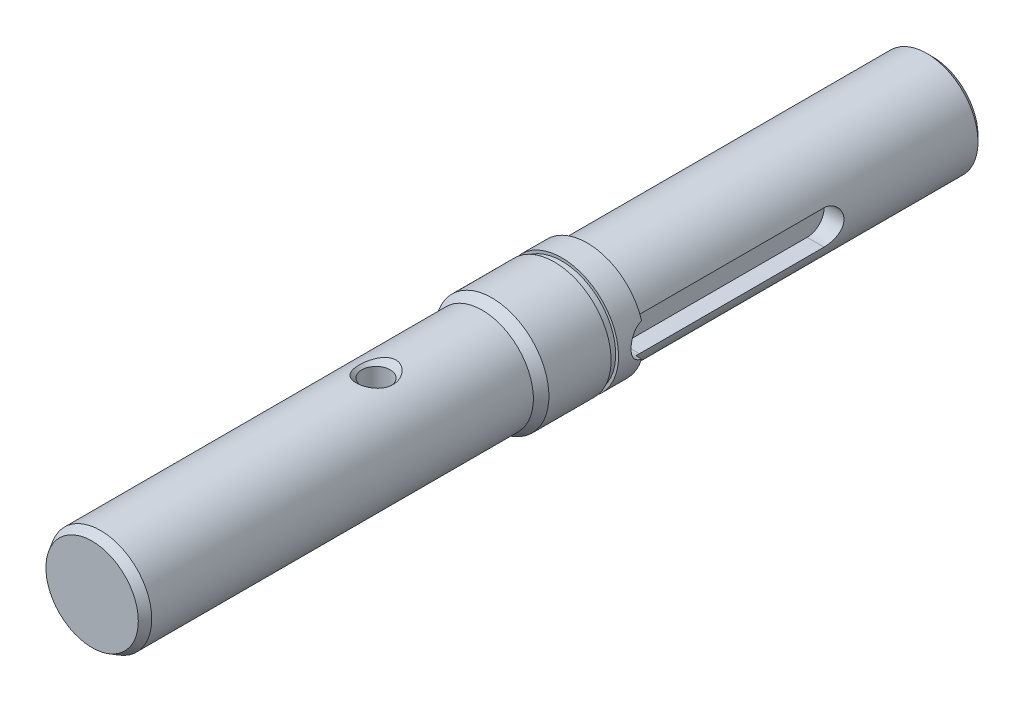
SolidWorks part; units mm, degrees
ref_plane "Face" through (0, 0, 0) normal (0, 0, 1) x (1, 0, 0)
ref_plane "Dessus" through (0, 0, 0) normal (0, 1, 0) x (1, 0, 0)
ref_plane "Droite" through (0, 0, 0) normal (1, 0, 0) x (0, 0, -1)
sketch "Esquisse1" plane through (0, 0, 0) normal (0, 0, 1) x (1, 0, 0)
  circle A0 centre (0, 0) radius 9
  dimension "D1" = 18
extrude "Base-Extrusion" add sketch "Esquisse1" along normal blind 148
chamfer "Chanfrein1" distance 1 angle 45 1 edges at (9, 0, 0)
hole_wizard "Trou taraudé M8x1.251" positions "Esquisse6" profile "Esquisse5" tap size "M8x1.25" standard "ISO"
sketch "Esquisse6" plane through (0, 0, 0) normal (0, 0, -1) x (-1, 0, 0)
  point P0 (0, 0)
sketch "Esquisse5" plane through (0, 0, 0) normal (1, 0, 0) x (0, 1, 0)
  line L0 (0, 0) -> (0, 32.5429)
  line L1 (0, 32.5429) -> (3.4, 30.5)
  line L2 (3.4, 30.5) -> (3.4, 0)
  line L5 (3.4, 0) -> (0, 0)
  line L10 (0, 32.5429) -> (-3.4, 30.5) construction
  line L11 (0, -6.35) -> (0, 107.95) construction
  dimension "Diamètre du perçage" = 6.8
  dimension "Profondeur du perçage" = 30.5
  dimension "Angle de pointe" = 118
ref_plane "Plan1" through (5.5, 0, 0) normal (1, 0, 0) x (0, 0, -1)
sketch "Esquisse11" plane through (0, 0, 0) normal (0, 1, 0) x (1, 0, 0)
  line L0 (0, 0) -> (0, -148.7529) construction
  line L1 (9, -60.8) -> (10, -60.8)
  line L2 (9, -148) -> (9, -1) construction
  line L3 (10, -60.8) -> (10, -77.5679)
  line L4 (10, -77.5679) -> (9, -79.3)
  line L5 (9, -79.3) -> (9, -60.8)
  dimension "D1" = 20
  dimension "D2" = 60.8
  dimension "D3" = 30
  dimension "D4" = 18.5
revolve "Révolution1" add sketch "Esquisse11" angle 360 about L0
sketch "Esquisse7" plane through (5.5, 0, 0) normal (1, 0, 0) x (0, 0, -1)
  line L0 (-60.1, 3) -> (-27.6, 3)
  line L1 (4.1515, 0) -> (-122.5917, 0) construction
  line L2 (-60.8, 0) -> (-1, 0) construction
  line L3 (-60.1, -3) -> (-27.6, -3)
  arc A0 (-27.6, 3) -> (-27.6, -3) centre (-27.6, 0) cw
  arc A1 (-60.1, 3) -> (-60.1, -3) centre (-60.1, 0) ccw
  dimension "D2" = 32.5
  dimension "D3" = 27.6
  dimension "D1" = 3
extrude "Enlèv. mat.-Extru.2" cut sketch "Esquisse7" along normal blind 10
chamfer "Chanfrein2" distance 1.5 angle 30 1 edges at (9, 0, 148)
sketch "Esquisse10" plane through (0, 0, 0) normal (1, 0, 0) x (0, -1, 0)
  line L0 (20.0755, -98) -> (-19.9764, -98) construction
  line L1 (0, -121.4362) -> (0, 0.4252) construction
  line L2 (0, -30.5) -> (0, 0) construction
  line L3 (-8, -95.5) -> (8, -95.5)
  line L4 (8, -95.5) -> (10, -93.5)
  line L5 (10, -93.5) -> (10, -98)
  line L7 (9, -146.5) -> (9, -79.3) construction
  line L8 (-8, -95.5) -> (-10, -93.5)
  line L9 (-10, -93.5) -> (-10, -98)
  line L10 (10, -98) -> (-10, -98)
  line L11 (-8.134, -148) -> (8.134, -148) construction
  point P15 (0, -95.5)
  dimension "D1" = 5
  dimension "D2" = 45
  dimension "D3" = 1
  dimension "D4" = 1
  dimension "D5" = 50
revolve "Enlèvement de matière-Révolution2" cut sketch "Esquisse10" angle 360 about L0
sketch "Esquisse12" plane through (0, 0, 0) normal (0, 1, 0) x (1, 0, 0)
  line L0 (0, 0) -> (0, -145.3972) construction
  line L1 (9.565, -60.8) -> (-10, -60.8) construction
  line L2 (9.5, -65.3) -> (12, -65.3)
  line L3 (9.5, -65.3) -> (9.5, -66.6)
  line L4 (9.5, -66.6) -> (12, -66.6)
  line L5 (12, -65.3) -> (12, -66.6)
  line L6 (10, -77.5679) -> (10, -63.1) construction
  dimension "D1" = 19
  dimension "D2" = 4.5
  dimension "D3" = 1.3
  dimension "D4" = 2
revolve "Enlèvement de matière-Révolution3" cut sketch "Esquisse12" angle 360 about L0
